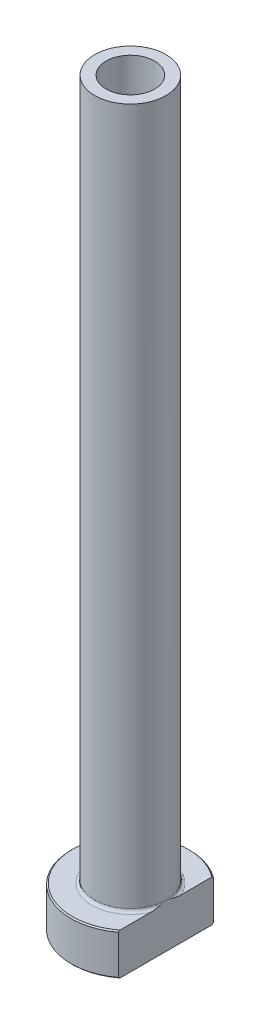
SolidWorks part; units mm, degrees
ref_plane "Front Plane" through (0, 0, 0) normal (0, 0, 1) x (1, 0, 0)
ref_plane "Top Plane" through (0, 0, 0) normal (0, 1, 0) x (1, 0, 0)
ref_plane "Right Plane" through (0, 0, 0) normal (1, 0, 0) x (0, 0, -1)
sketch "Sketch1" plane through (0, 0, 0) normal (0, 0, 1) x (1, 0, 0)
  line L0 (-4.1, 125) -> (-6, 125)
  line L1 (-6, 125) -> (-6, 7)
  line L2 (-6, 7) -> (-10, 7)
  line L3 (-10, 7) -> (-10, 0)
  line L4 (8.8, 0) -> (-8.8, 0) construction
  line L5 (-10, 0) -> (-4.35, 0)
  line L6 (-4.1, 80) -> (-4.1, 125)
  line L7 (0, 92.1877) -> (0, -15.5353) construction
  line L8 (0, -11) -> (0, 11) construction
  line L9 (-4.1, 80) -> (-4.35, 68)
  line L10 (-4.35, 68) -> (-4.35, 0)
  dimension "D1" = 0.25
  dimension "ID" = 8.2
  dimension "OD" = 12
  dimension "L" = 125
  dimension "H" = 20
  dimension "T" = 7
  dimension "N" = 45
  dimension "D2" = 12
  dimension "L-N" = 80
revolve "Revolve1" add sketch "Sketch1" angle 360 about L7
fillet "Fillet1" radius 0.5 1 edges at (0, 7, 6)
chamfer "Chamfer1" distance 0.2 angle 45 2 edges at (0, 7, 10) (0, 0, 10)
sketch "Sketch2" plane through (0, 0, 0) normal (0, -1, 0) x (1, 0, 0)
  line L0 (6, 8) -> (6, -8)
  circle A0 centre (0, 0) radius 10 construction
  arc A1 (6, 8) -> (6, -8) centre (0, 0) cw
  circle A2 centre (0, 0) radius 6 construction
extrude "Cut-Extrude1" cut sketch "Sketch2" against normal through all
chamfer "Chamfer2" distance 0.5 angle 45 1 edges at (0, 0, 4.35)
